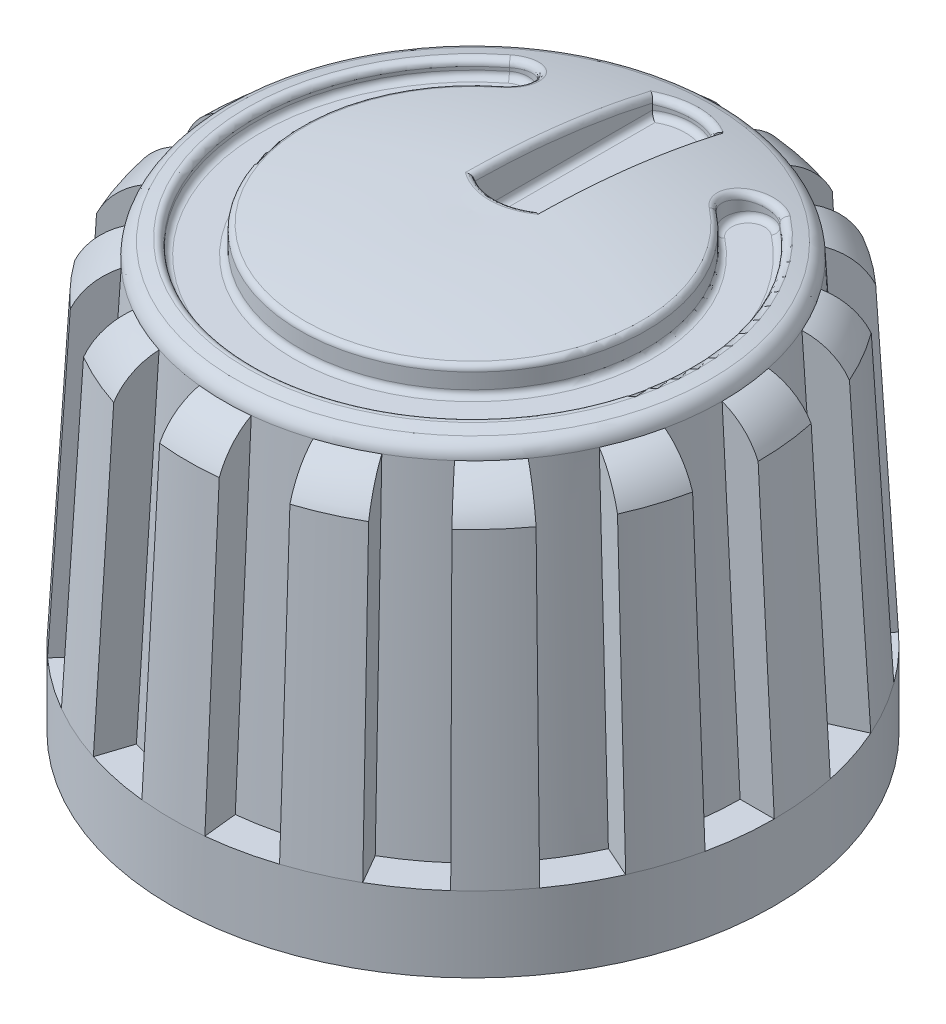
SolidWorks part; units mm, degrees
ref_plane "Front" through (0, 0, 0) normal (0, 0, 1) x (1, 0, 0)
ref_plane "Top" through (0, 0, 0) normal (0, 1, 0) x (1, 0, 0)
ref_plane "Right" through (0, 0, 0) normal (1, 0, 0) x (0, 0, -1)
sketch "Sketch1" plane through (0, 0, 0) normal (0, 0, 1) x (1, 0, 0)
  line L0 (0, 0) -> (0, 3.81)
  line L1 (0, 0) -> (2.286, 0)
  line L2 (2.286, 0) -> (2.0955, 3.556)
  arc A0 (2.0955, 3.556) -> (0, 3.81) centre (0.226, -3.0967) ccw
  dimension "D1" = 2.0955
  dimension "D2" = 3.556
  dimension "D3" = 3.81
  dimension "D4" = 2.286
revolve "Revolve1" add sketch "Sketch1" angle 360 about L0
fillet "Fillet1" radius 0.127 1 edges at (0, 3.556, -2.0955)
sketch "Sketch2" plane through (0, 0, 0) normal (0, 0, 1) x (1, 0, 0)
  line L1 (0, 0) -> (2.54, 0)
  line L2 (0, 0) -> (0, 0.635)
  line L3 (0, 0.635) -> (2.54, 0.635)
  line L4 (2.54, 0) -> (2.54, 0.635)
  dimension "D1" = 0.635
  dimension "D2" = 2.54
revolve "Revolve2" add sketch "Sketch2" angle 360 about L2
sketch "Sketch3" plane through (0, 0, 0) normal (0, 0, 1) x (1, 0, 0)
  line L0 (2.54, 0.635) -> (2.252, 0.635)
  line L1 (2.54, 0.635) -> (-2.54, 0.635) construction
  line L2 (2.252, 0.635) -> (2.1004, 3.4645)
  line L3 (2.54, 0.635) -> (2.4038, 3.1777)
  line L4 (2.252, 0.635) -> (2.1004, 3.4645) construction
  line L5 (2.54, 0) -> (2.54, 0.635) construction
  arc A0 (2.1004, 3.4645) -> (2.4038, 3.1777) centre (1.9144, 2.9639) cw
revolve "Revolve3" add sketch "Sketch3" angle 12 about axis through (0, 0, 0) along (0, 1, 0)
pattern_circular "CirPattern1" count 15 over 360 about axis through (0, 0, 0) along (0, 1, 0) of "Revolve3"
ref_plane "Plane1" through (0, 3.8608, 0) normal (0, 1, 0) x (-1, 0, 0)
sketch "Sketch4" plane through (0, 3.8608, 0) normal (0, -1, 0) x (1, 0, 0)
  line L2 (-0.254, -1.7653) -> (-0.254, -0.2667)
  line L4 (0.254, -1.7653) -> (0.254, -0.2667)
  arc A0 (-1.1398, -1.4464) -> (-0.904, -1.1471) centre (-1.0219, -1.2967) ccw
  arc A1 (1.1398, -1.4464) -> (-1.1398, -1.4464) centre (0, 0) ccw
  arc A2 (0.904, -1.1471) -> (-0.904, -1.1471) centre (0, 0) ccw
  arc A4 (0.904, -1.1471) -> (1.1398, -1.4464) centre (1.0219, -1.2967) ccw
  arc A5 (-0.254, -1.7653) -> (0.254, -1.7653) centre (0, -1.3801) ccw
  arc A6 (-0.254, -0.2667) -> (0.254, -0.2667) centre (0, -0.6519) cw
  dimension "D1" = 0.508
  dimension "D4" = 0.254
extrude "Cut-Extrude1" cut sketch "Sketch4" along normal blind 0.381
fillet "Fillet2" radius 0.0508 16 edges at (-0.0415, 3.8136, -0.1924) (0.0386, 3.6225, -1.8399) (0, 3.4798, -1.8415) (0.254, 3.4798, -1.016) (0, 3.4798, -0.1905) (-0.254, 3.4798, -1.016) (0, 3.7025, 1.4605) (-0.8615, 3.6667, -1.3996) (0, 3.6222, 1.8415) (0.8844, 3.6589, -1.4286) (0.8723, 3.4798, -1.4146) (0, 3.4798, 1.8415) (-0.8723, 3.4798, -1.4146) (0, 3.4798, 1.4605)
sketch "Sketch5" plane through (0, 0, 0) normal (0, -1, 0) x (1, 0, 0)
  circle A0 centre (0, 0) radius 1.143
  dimension "D1" = 2.286
extrude "Cut-Extrude2" cut sketch "Sketch5" against normal blind 1.524
